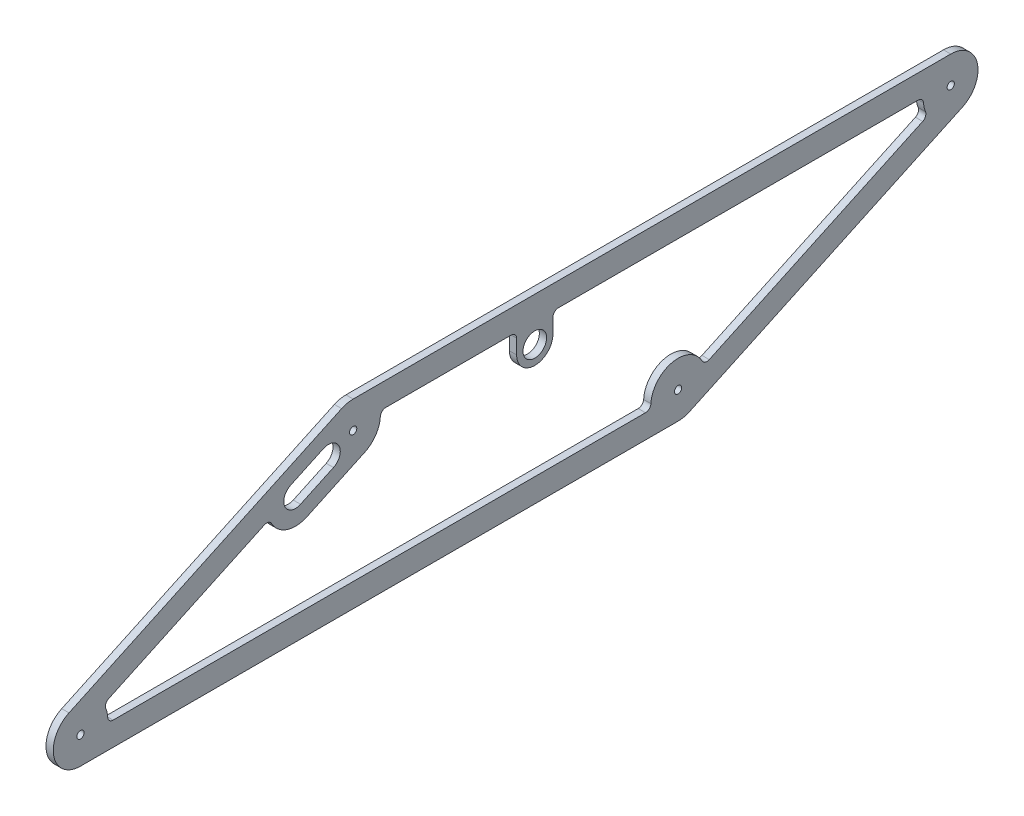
SolidWorks part; units mm, degrees
ref_plane "Front Plane" through (0, 0, 0) normal (0, 0, 1) x (1, 0, 0)
ref_plane "Top Plane" through (0, 0, 0) normal (0, 1, 0) x (1, 0, 0)
ref_plane "Right Plane" through (0, 0, 0) normal (1, 0, 0) x (0, 0, -1)
sketch "Sketch1" plane through (0, 0, 0) normal (1, 0, 0) x (0, 0, -1)
  line L0 (-3.3254, 0) -> (-332.3394, 0)
  line L1 (3.0139, 1.4054) -> (153.1293, 71.4054)
  line L2 (-338.6786, 28.5946) -> (-188.5632, 98.5946)
  line L3 (146.7901, 100) -> (-182.2239, 100)
  arc A0 (3.0139, 1.4054) -> (-3.3254, 0) centre (-3.3254, 15) cw
  arc A1 (153.1293, 71.4054) -> (146.7901, 100) centre (146.7901, 85) ccw
  arc A2 (-188.5632, 98.5946) -> (-182.2239, 100) centre (-182.2239, 85) cw
  arc A3 (-332.3394, 0) -> (-338.6786, 28.5946) centre (-332.3394, 15) cw
  point P7 (0, 0)
  point P12 (-185.5493, 100)
  point P15 (-400, 0)
  dimension "D4" = 15
  dimension "D1" = 100
  dimension "D2" = 400
  dimension "D3" = 25
extrude "Boss-Extrude1" add sketch "Sketch1" along normal blind 4
sketch "Sketch2" plane through (4, 0, 0) normal (1, 0, 0) x (0, 0, -1)
  circle A0 centre (-332.3394, 15) radius 2
extrude "Cut-Extrude1" cut sketch "Sketch2" against normal blind 34
sketch "Sketch3" plane through (0, 0, 0) normal (-1, 0, 0) x (0, 0, 1)
  circle A0 centre (182.2239, 85) radius 2
extrude "Cut-Extrude2" cut sketch "Sketch3" against normal blind 34
sketch "Sketch4" plane through (4, 0, 0) normal (1, 0, 0) x (0, 0, -1)
  line L0 (-2.4802, 13.1874) -> (147.6353, 83.1874)
  line L1 (-3.3254, 13) -> (-332.3394, 13)
  line L2 (-333.1846, 16.8126) -> (-183.0691, 86.8126)
  line L3 (-182.2239, 87) -> (146.7901, 87)
  circle A0 centre (-332.3394, 15) radius 15
  circle A1 centre (-182.2239, 85) radius 15
  circle A2 centre (146.7901, 85) radius 15
  circle A3 centre (-3.3254, 15) radius 15
  circle A4 centre (-182.2239, 85) radius 2
  circle A5 centre (-332.3394, 15) radius 2
  circle A6 centre (-3.3254, 15) radius 2
  circle A7 centre (146.7901, 85) radius 2
  dimension "D1" = 4
  dimension "D2" = 4
extrude "Cut-Extrude3" cut sketch "Sketch4" against normal blind 34 contours A3 L0 A2 L3 A1 L2 A0 L1
sketch "Sketch8" plane through (4, 0, 0) normal (1, 0, 0) x (0, 0, -1)
  line L0 (-332.3394, 0) -> (-3.3254, 0) construction
  line L1 (-92.2239, 76) -> (-92.2239, 100)
  line L2 (146.7901, 100) -> (-182.2239, 100) construction
  line L3 (-92.2239, 100) -> (-72.2239, 100)
  line L4 (-72.2239, 100) -> (-72.2239, 76)
  circle A1 centre (-82.2239, 76) radius 10
  dimension "D1" = 76
extrude "Boss-Extrude3" add sketch "Sketch8" against normal blind 4 contours A1 | A1 L4 L1 M16
sketch "Sketch5" plane through (4, 0, 0) normal (1, 0, 0) x (0, 0, -1)
  circle A0 centre (-82.2239, 76) radius 6.5
extrude "Cut-Extrude5" cut sketch "Sketch5" against normal blind 4
sketch "Sketch9" plane through (4, 0, 0) normal (1, 0, 0) x (0, 0, -1)
  line L0 (-188.5632, 98.5946) -> (-338.6786, 28.5946) construction
  line L1 (-207.6054, 56.6137) -> (-175.8846, 71.4054)
  line L2 (-175.8846, 71.4054) -> (-188.5632, 98.5946)
  line L3 (-188.5632, 98.5946) -> (-220.2839, 83.803)
  circle A0 centre (-213.9447, 70.2084) radius 15
  circle A1 centre (-182.2239, 85) radius 2 construction
  arc A2 (-196.5424, 80.5299) -> (-167.3578, 87) centre (-182.2239, 85) ccw construction
  dimension "D1" = 15
  dimension "D2" = 35
extrude "Boss-Extrude4" add sketch "Sketch9" against normal blind 4 contours A0 M16 | A0 L1 M17 M16
sketch "Sketch10" plane through (4, 0, 0) normal (1, 0, 0) x (0, 0, -1)
  line L0 (-213.9447, 70.2084) -> (-195.8185, 78.6607) construction
  line L1 (-216.6917, 76.0994) -> (-198.5655, 84.5517)
  line L2 (-211.1976, 64.3174) -> (-193.0715, 72.7697)
  arc A0 (-216.6917, 76.0994) -> (-211.1976, 64.3174) centre (-213.9447, 70.2084) ccw
  arc A1 (-193.0715, 72.7697) -> (-198.5655, 84.5517) centre (-195.8185, 78.6607) ccw
  point P3 (-204.8816, 74.4345)
extrude "Cut-Extrude6" cut sketch "Sketch10" against normal blind 4
sketch "Sketch11" plane through (0, 0, 0) normal (-1, 0, 0) x (0, 0, 1)
  circle A0 centre (3.3254, 15) radius 2
  circle A1 centre (-146.7901, 85) radius 2
extrude "Cut-Extrude7" cut sketch "Sketch11" against normal blind 10
fillet "Fillet1" radius 3 10 edges at (2, 87, -131.924) (2, 76.9047, -134.1621) (2, 19.4701, -10.9931) (2, 13, 18.1915) (2, 87, 92.2239) (2, 87, 72.2239) (2, 87, 167.3578) (2, 65.7383, 228.2631) (2, 23.0953, 319.7114) (2, 13, 317.4733)
